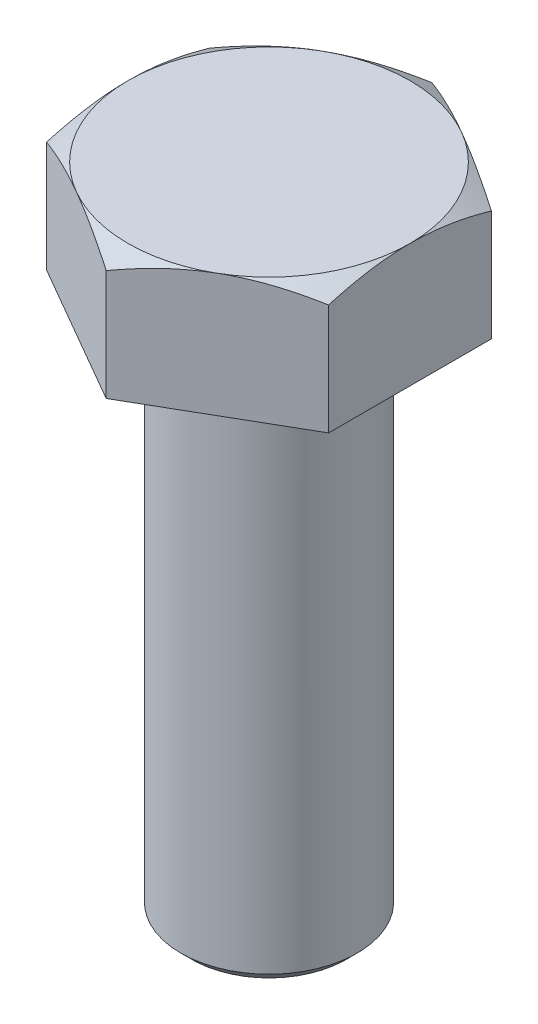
SolidWorks part; units mm, degrees
ref_plane "Front" through (0, 0, 0) normal (0, 0, 1) x (1, 0, 0)
ref_plane "Top" through (0, 0, 0) normal (0, 1, 0) x (1, 0, 0)
ref_plane "Right" through (0, 0, 0) normal (1, 0, 0) x (0, 0, -1)
sketch "Sketch1" plane through (0, 0, 0) normal (0, 1, 0) x (1, 0, 0)
  line L1 (0, 9.2376) -> (-8, 4.6188)
  line L2 (-8, 4.6188) -> (-8, -4.6188)
  line L3 (-8, -4.6188) -> (0, -9.2376)
  line L4 (0, -9.2376) -> (8, -4.6188)
  line L5 (8, -4.6188) -> (8, 4.6188)
  line L6 (8, 4.6188) -> (0, 9.2376)
  circle A0 centre (0, 0) radius 8 construction
  dimension "D1" = 16
extrude "Boss-Extrude1" add sketch "Sketch1" along normal blind 7
sketch "Sketch2" plane through (0, 0, 0) normal (0, -1, 0) x (1, 0, 0)
  circle A0 centre (0, 0) radius 5
  dimension "D1" = 10
extrude "Boss-Extrude2" add sketch "Sketch2" along normal blind 30
sketch "Sketch3" plane through (0, 7, 0) normal (0, 1, 0) x (1, 0, 0)
  line L0 (8, 4.6188) -> (0, 9.2376) construction
  circle A0 centre (0, 0) radius 8
extrude "Cut-Extrude1" cut sketch "Sketch3" against normal blind 68 draft 60 flip side to cut
sketch "Sketch4" plane through (0, -30, 0) normal (0, -1, 0) x (1, 0, 0)
  circle A0 centre (0, 0) radius 4.375
  dimension "D1" = 8.75
extrude "Cut-Extrude2" cut sketch "Sketch4" against normal blind 68 draft 45 flip side to cut
